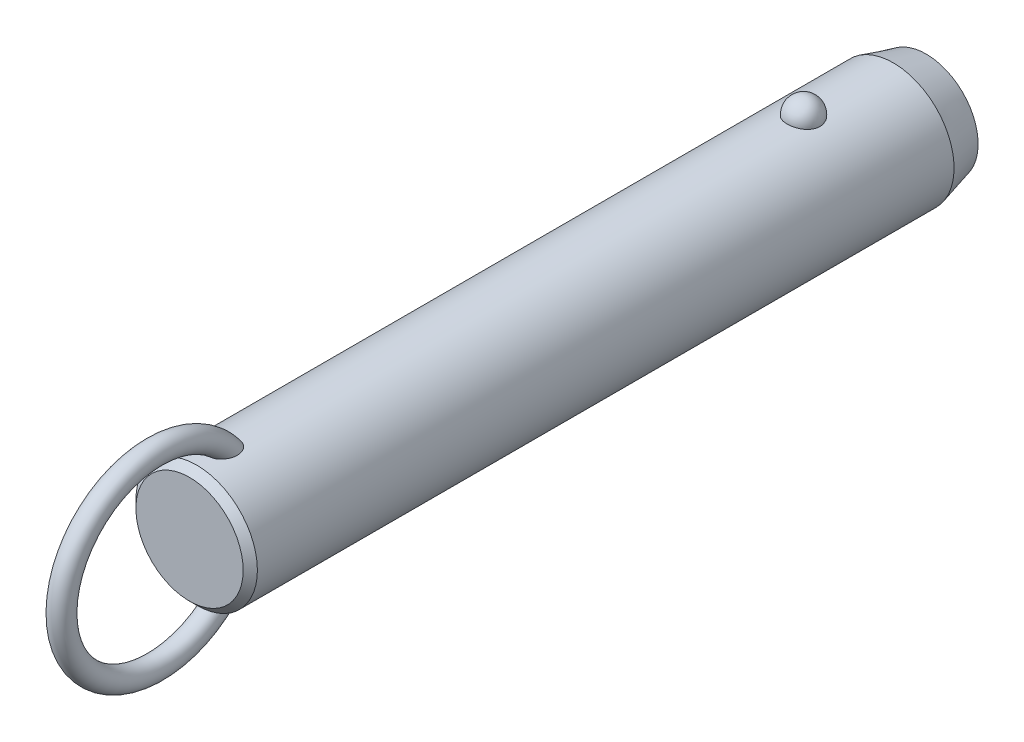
SolidWorks part; units mm, degrees
ref_plane "Front Plane" through (0, 0, 0) normal (0, 0, 1) x (1, 0, 0)
ref_plane "Top Plane" through (0, 0, 0) normal (0, 1, 0) x (1, 0, 0)
ref_plane "Right Plane" through (0, 0, 0) normal (1, 0, 0) x (0, 0, -1)
sketch "Sketch2" plane through (0, 0, 0) normal (0, 0, 1) x (1, 0, 0)
  circle A0 centre (0, 0) radius 11.1
  point P3 (0, 11.1)
  dimension "D1" = 22.2
extrude "Boss-Extrude1" add sketch "Sketch2" along normal blind 96.5
sketch "Sketch3" plane through (0, 0, 0) normal (0, 0, -1) x (-1, 0, 0)
  circle A0 centre (0, 0) radius 11.1
  dimension "D1" = 22.2
extrude "Boss-Extrude2" add sketch "Sketch3" along normal blind 25.4
chamfer "Chamfer1" distance 6 angle 15 1 edges at (-11.1, 0, -25.4)
sketch "Sketch12" plane through (0, 0, 0) normal (1, 0, 0) x (0, 0, -1)
  line L0 (-96.5, 11.1) -> (-96.5, -11.1) construction
  point P0 (-96.5, 0)
sketch "Sketch13" plane through (0, 0, 0) normal (1, 0, 0) x (0, 0, -1)
  circle A0 centre (-115.55, 0) radius 19.05
  point P2 (-96.5, 0)
  dimension "D1" = 38.1
sketch "Sketch14" plane through (0, 0, 0) normal (0, 1, 0) x (1, 0, 0)
  circle A0 centre (0, -98.5) radius 2
  point P2 (0, -96.5)
  dimension "D1" = 4
sweep "Sweep1" add profiles "Sketch14" path "Sketch13"
sketch "Sketch15" plane through (0, 0, 96.5) normal (0, 0, 1) x (1, 0, 0)
  circle A0 centre (0, 0) radius 11.1
  dimension "D1" = 22.2
extrude "Boss-Extrude3" add sketch "Sketch15" along normal blind 12.7
chamfer "Chamfer2" distance 1.3 angle 45 1 edges at (11.1, 0, 109.2)
sketch "Sketch18" plane through (0, 0, 0) normal (1, 0, 0) x (0, 0, -1)
  line L0 (19.4, 11.1) -> (-100.068, 11.1) construction
  line L1 (3, 14.1) -> (3, 8.1)
  line L2 (-100.068, -11.1) -> (19.4, -11.1) construction
  arc A0 (3, 14.1) -> (3, 8.1) centre (3, 11.1) ccw
  point P4 (0, 11.1)
  dimension "D1" = 25.2
revolve "Revolve1" add sketch "Sketch18" angle 360 about L1
